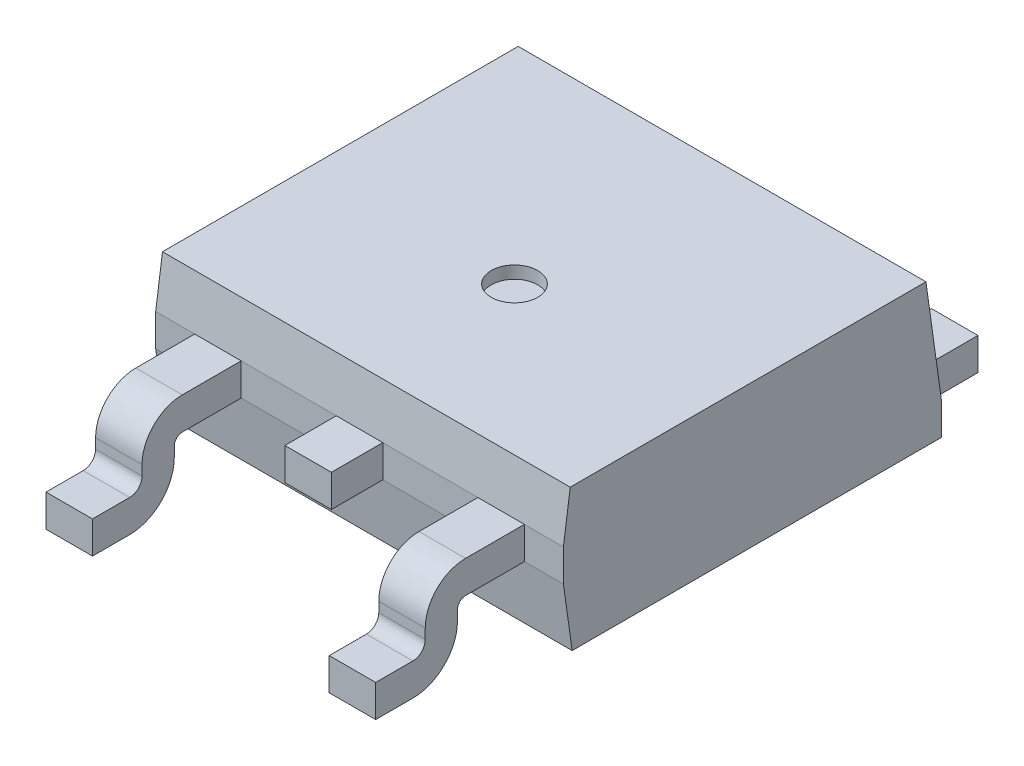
SolidWorks part; units mm, degrees
ref_plane "Front" through (0, 0, 0) normal (0, 0, 1) x (1, 0, 0)
ref_plane "Top" through (0, 0, 0) normal (0, 1, 0) x (1, 0, 0)
ref_plane "Right" through (0, 0, 0) normal (1, 0, 0) x (0, 0, -1)
sketch "Sketch1" plane through (0, 0, 0) normal (1, 0, 0) x (0, 0, -1)
  line L0 (0, 1) -> (0, 1.52)
  line L1 (0.1405, 0) -> (6.1, 0) construction
  line L2 (0, 0) -> (0, 2.3) construction
  line L3 (0.1096, 2.3) -> (5.8498, 2.3) construction
  line L4 (6.1, 0) -> (6.1, 2.3) construction
  line L5 (0, 1) -> (0.1405, 0)
  line L6 (0, 1.52) -> (0.1096, 2.3)
  line L7 (0.1096, 2.3) -> (5.8498, 2.3)
  line L8 (0.1405, 0) -> (6.1, 0)
  line L9 (6.1, 0) -> (6.1, 0.52)
  line L10 (6.1, 0.52) -> (5.8498, 2.3)
  dimension "D1" = 6.1
  dimension "D2" = 2.3
  dimension "D3" = 8
  dimension "D4" = 8
  dimension "D5" = 1
  dimension "D6" = 0.52
  dimension "D7" = 8
  dimension "D8" = 0.52
extrude "BOX" add sketch "Sketch1" along normal blind 6.58
sketch "Sketch2" plane through (0, 0, 0) normal (0, -1, 0) x (1, 0, 0)
  line L1 (6.58, -6.1) -> (0, -6.1) construction
  line L2 (0.61, -6.1) -> (5.97, -6.1)
  line L3 (0.61, -6.1) -> (0.61, -1.78)
  line L4 (0.61, -1.78) -> (5.97, -1.78)
  line L6 (5.97, -6.1) -> (5.97, -1.78)
  line L7 (0, -0.1405) -> (0, -6.1) construction
  dimension "D1" = 0.61
  dimension "D2" = 5.36
  dimension "D3" = 4.32
extrude "Cut-Extrude1" cut sketch "Sketch2" against normal blind 0.52
sketch "Sketch3" plane through (0, 0.52, 0) normal (0, -1, 0) x (1, 0, 0)
  line L0 (5.97, -6.1) -> (5.97, -1.78) construction
  line L1 (0.61, -1.78) -> (0.61, -6.1) construction
  line L2 (5.97, -1.78) -> (0.61, -1.78) construction
  line L3 (5.97, -7.3) -> (5.97, -5.7)
  line L4 (0.61, -1.78) -> (0.61, -5.35)
  line L5 (5.97, -1.78) -> (0.61, -1.78)
  line L6 (0.61, -7.3) -> (1.36, -7.3)
  line L7 (0.61, -6.1) -> (0, -6.1) construction
  line L8 (1.36, -7.3) -> (1.36, -6.8)
  line L9 (1.36, -6.8) -> (5.22, -6.8)
  line L10 (5.22, -6.8) -> (5.22, -7.3)
  line L11 (5.22, -7.3) -> (5.97, -7.3)
  line L12 (0.61, -6.1) -> (5.97, -6.1) construction
  line L13 (1.86, -5.7) -> (4.72, -5.7)
  line L14 (1.61, -5.95) -> (1.61, -6.05)
  line L15 (1.86, -6.3) -> (4.72, -6.3)
  line L16 (4.97, -5.95) -> (4.97, -6.05)
  line L17 (3.29, -1.78) -> (3.29, -3.9685) construction
  line L18 (0.61, -5.7) -> (0.91, -5.7)
  line L19 (0.91, -5.7) -> (0.91, -5.35)
  line L20 (0.91, -5.35) -> (0.61, -5.35)
  line L21 (5.67, -5.35) -> (5.97, -5.35)
  line L22 (5.67, -5.7) -> (5.67, -5.35)
  line L23 (5.97, -5.7) -> (5.67, -5.7)
  line L24 (0.61, -5.7) -> (0.61, -7.3)
  line L25 (5.97, -5.35) -> (5.97, -1.78)
  arc A0 (1.61, -6.05) -> (1.86, -6.3) centre (1.86, -6.05) ccw
  arc A1 (1.86, -5.7) -> (1.61, -5.95) centre (1.86, -5.95) ccw
  arc A2 (4.97, -5.95) -> (4.72, -5.7) centre (4.72, -5.95) ccw
  arc A3 (4.72, -6.3) -> (4.97, -6.05) centre (4.72, -6.05) ccw
  dimension "D9" = 0.25
  dimension "D1" = 1.2
  dimension "D2" = 0.75
  dimension "D3" = 0.75
  dimension "D4" = 0.5
  dimension "D5" = 1
  dimension "D6" = 1
  dimension "D7" = 0.2
  dimension "D8" = 0.6
  dimension "D10" = 0.35
  dimension "D11" = 0.3
extrude "Extrude2" add sketch "Sketch3" along normal blind 0.52 separate body
sketch "Sketch4" plane through (0, 0, 0) normal (0, 0, 1) x (1, 0, 0)
  line L0 (3.29, 2.3) -> (3.29, -1.2999) construction
  line L1 (6.58, 2.3) -> (0, 2.3) construction
  line L2 (6.58, 1.52) -> (0, 1.52) construction
  line L3 (0.63, 1.52) -> (1.38, 1.52)
  line L4 (0.63, 1.52) -> (0.63, 1)
  line L5 (0.63, 1) -> (1.38, 1)
  line L6 (1.38, 1.52) -> (1.38, 1)
  line L7 (6.58, 1) -> (0, 1) construction
  line L8 (1.005, 1.52) -> (1.005, 0.6833) construction
  line L9 (5.2, 1.52) -> (5.2, 1)
  line L10 (5.95, 1) -> (5.2, 1)
  line L11 (5.95, 1.52) -> (5.95, 1)
  line L12 (5.95, 1.52) -> (5.2, 1.52)
  dimension "D1" = 0.75
  dimension "D2" = 2.285
sketch "Sketch5" plane through (6.58, 0, 0) normal (1, 0, 0) x (0, 0, -1)
  line L0 (-1.6, 0.87) -> (-1.6, 0.711)
  line L1 (-1.8, 0.511) -> (-2.4, 0.511)
  line L2 (7.3, 0) -> (7.3, 0.52) construction
  line L3 (-0.95, 1.52) -> (0, 1.52)
  line L4 (0.1405, 0) -> (6.1, 0) construction
  line L5 (0, 1) -> (0, 3.2398) construction
  arc A0 (-1.6, 0.87) -> (-0.95, 1.52) centre (-0.95, 0.87) cw
  arc A1 (-1.6, 0.711) -> (-1.8, 0.511) centre (-1.8, 0.711) cw
  dimension "D4" = 0.65
  dimension "D5" = 0.2
  dimension "D1" = 9.7
  dimension "D2" = 0.511
  dimension "D3" = 0.8
sweep "Sweep1" add profiles "Sketch4" path "Sketch5"
sketch "Sketch6" plane through (0, 0, 0) normal (0, 0, 1) x (1, 0, 0)
  line L0 (3.29, 2.3) -> (3.29, -0.5631) construction
  line L1 (6.58, 2.3) -> (0, 2.3) construction
  line L2 (5.2, 1.52) -> (1.38, 1.52) construction
  line L3 (2.915, 1.52) -> (3.665, 1.52)
  line L4 (2.915, 1.52) -> (2.915, 1)
  line L5 (2.915, 1) -> (3.665, 1)
  line L6 (3.665, 1.52) -> (3.665, 1)
  line L7 (5.2, 1) -> (1.38, 1) construction
  point P6 (3.29, 1.52)
  point P14 (3.29, 1)
  dimension "D1" = 0.75
extrude "Extrude3" add sketch "Sketch6" along normal blind 0.83
sketch "Sketch7" plane through (0, 2.3, 0) normal (0, 1, 0) x (1, 0, 0)
  line L0 (3.29, 0) -> (3.29, 2.5) construction
  line L1 (3.665, 0) -> (2.915, 0) construction
  circle A0 centre (3.29, 2.5) radius 0.375
  dimension "D1" = 0.75
extrude "Cut-Extrude2" cut sketch "Sketch7" against normal blind 0.2
